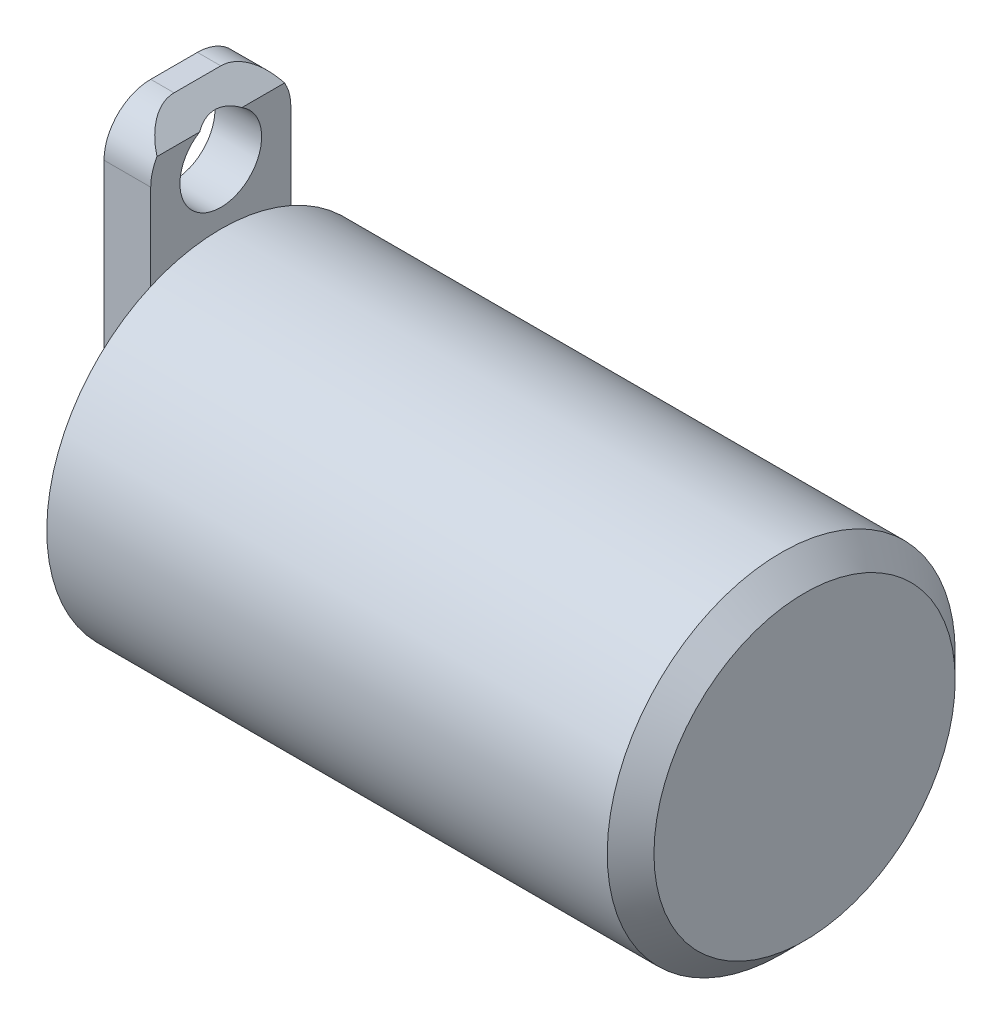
SolidWorks part; units mm, degrees
ref_plane "Front Plane" through (0, 0, 0) normal (0, 0, 1) x (1, 0, 0)
ref_plane "Top Plane" through (0, 0, 0) normal (0, 1, 0) x (1, 0, 0)
ref_plane "Right Plane" through (0, 0, 0) normal (1, 0, 0) x (0, 0, -1)
sketch "Sketch1" plane through (0, 0, 0) normal (1, 0, 0) x (0, 0, -1)
  circle A0 centre (0, 0) radius 14.9
  dimension "D1" = 29.8
extrude "Boss-Extrude1" add sketch "Sketch1" along normal blind 50
chamfer "Chamfer1" distance 2 angle 45 1 edges at (50, 0, -14.9)
sketch "Sketch2" plane through (0, 0, 0) normal (-1, 0, 0) x (0, 0, 1)
  line L0 (0, 0) -> (6, 0)
  line L1 (6, 0) -> (6, 21)
  line L2 (2, 25) -> (-2, 25)
  line L3 (-6, 21) -> (-6, 0)
  line L4 (-6, 0) -> (0, 0)
  line L5 (0, 0) -> (0, 20) construction
  circle A0 centre (0, 20) radius 3.5
  arc A1 (-2, 25) -> (-6, 21) centre (-2, 21) ccw
  arc A2 (6, 21) -> (2, 25) centre (2, 21) ccw
  point P10 (-6, 25)
  point P13 (6, 25)
  dimension "D3" = 7
  dimension "D5" = 4
  dimension "D1" = 25
  dimension "D2" = 12
  dimension "D4" = 20
extrude "Boss-Extrude2" add sketch "Sketch2" along normal blind 4
sketch "Sketch3" plane through (0, 0, 6) normal (0, 0, 1) x (1, 0, 0)
  line L0 (0, 21) -> (0, 25) construction
  line L1 (0, 21) -> (0, 25) construction
  line L2 (0, 25) -> (-2, 25)
  line L3 (-2, 25) -> (0, 23)
  line L4 (0, 25) -> (0, 23)
  dimension "D1" = 45
  dimension "D2" = 2
extrude "Cut-Extrude1" cut sketch "Sketch3" against normal through all
